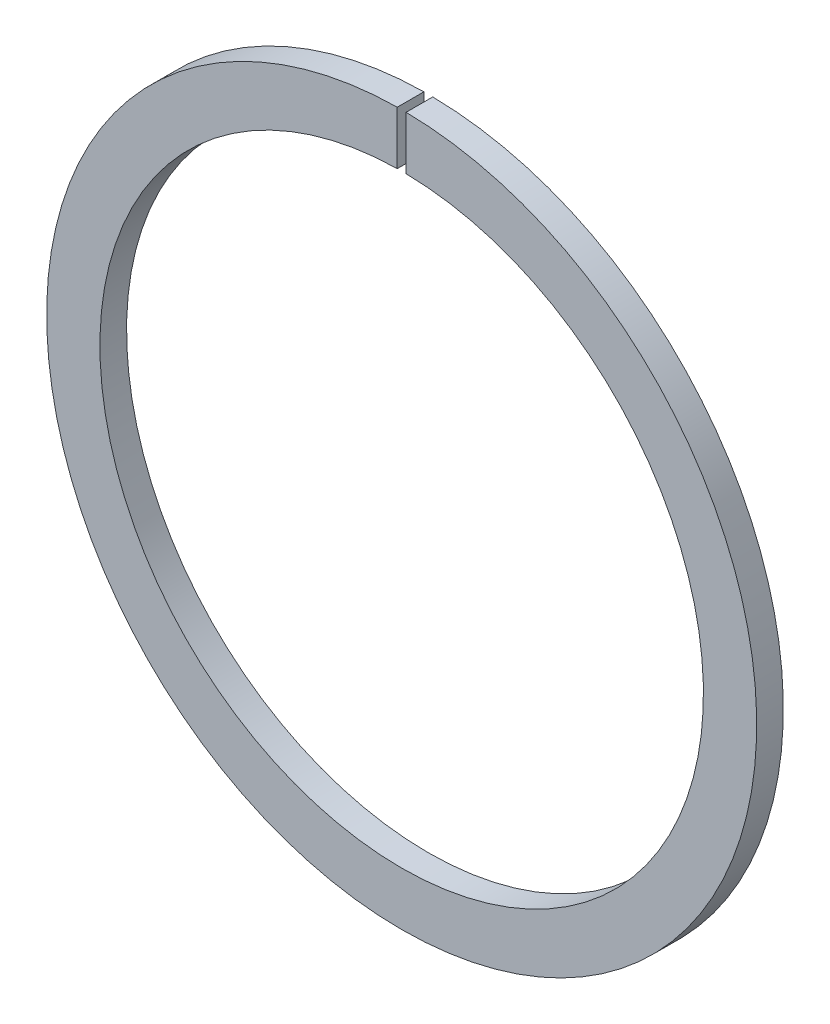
SolidWorks part; units mm, degrees
ref_plane "Face" through (0, 0, 0) normal (0, 0, 1) x (1, 0, 0)
ref_plane "Dessus" through (0, 0, 0) normal (0, 1, 0) x (1, 0, 0)
ref_plane "Droite" through (0, 0, 0) normal (1, 0, 0) x (0, 0, -1)
sketch "Esquisse1" plane through (0, 0, 0) normal (0, 0, 1) x (1, 0, 0)
  line L0 (-0.25, 16.9982) -> (-0.25, 19.9984)
  line L1 (0, 0) -> (0, 24.1939) construction
  line L2 (0.25, 16.9982) -> (0.25, 19.9984)
  arc A0 (-0.25, 19.9984) -> (0.25, 19.9984) centre (0, 0) ccw
  arc A1 (-0.25, 16.9982) -> (0.25, 16.9982) centre (0, 0) ccw
  dimension "D1" = 40
  dimension "D2" = 34
  dimension "D3" = 0.5
extrude "Extrusion1" add sketch "Esquisse1" along normal blind 1.5
